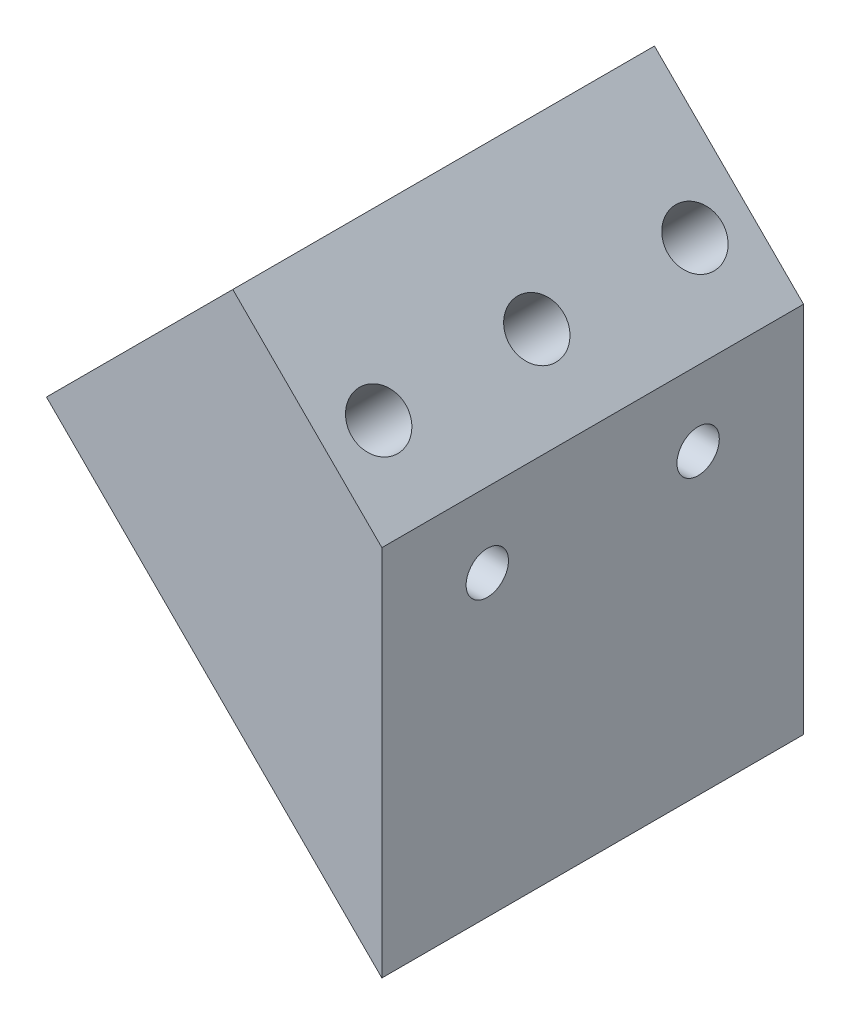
SolidWorks part; units mm, degrees
ref_plane "Front Plane" through (0, 0, 0) normal (0, 0, 1) x (1, 0, 0)
ref_plane "Top Plane" through (0, 0, 0) normal (0, 1, 0) x (1, 0, 0)
ref_plane "Right Plane" through (0, 0, 0) normal (1, 0, 0) x (0, 0, -1)
sketch "Sketch1" plane through (0, 0, 0) normal (0, 0, 1) x (1, 0, 0)
  line L1 (0, 0) -> (-40.4112, 40.4112)
  line L2 (-40.4112, 40.4112) -> (0, 80.8223)
  line L3 (0, 80.8223) -> (0, 0)
  dimension "D1" = 45
  dimension "D2" = 90
  dimension "D3" = 57.15
extrude "Boss-Extrude1" add sketch "Sketch1" along normal mid plane 50.8
hole_wizard "1/4-20 Tapped Hole1" positions "Sketch5" profile "Sketch4" tap size "1/4-20" standard "ANSI Inch"
sketch "Sketch5" plane through (0, 0, 0) normal (1, 0, 0) x (0, 0, -1)
  line L0 (-12.7, 35.9207) -> (12.7, 35.9207) construction
  line L2 (0, 0) -> (0, 35.9207) construction
  point P0 (-12.7, 35.9207)
  point P2 (12.7, 35.9207)
  dimension "D1" = 35.9207
  dimension "D2" = 25.4
sketch "Sketch4" plane through (0, 35.9207, 12.7) normal (0, 1, 0) x (0, 0, -1)
  line L0 (0, 0) -> (0, 40.4112)
  line L1 (0, 40.4112) -> (2.5527, 40.4112)
  line L2 (2.5527, 40.4112) -> (2.5527, 0)
  line L5 (2.5527, 0) -> (0, 0)
  line L11 (0, -6.35) -> (0, 107.95) construction
  dimension "Thru Tap Drill Dia." = 5.1054
  dimension "Thru Tap Drill Depth" = 40.4112
sketch "Sketch6" plane through (0, 0, 25.4) normal (0, 0, 1) x (1, 0, 0)
  line L0 (-17.9605, 62.8618) -> (0, 44.9013)
  line L1 (0, 80.8223) -> (-40.4112, 40.4112) construction
  line L2 (0, 0) -> (0, 80.8223) construction
  line L3 (0, 44.9013) -> (0, 80.8223)
  line L4 (0, 80.8223) -> (-17.9605, 62.8618)
  line L5 (-40.4112, 40.4112) -> (0, 0) construction
  dimension "D1" = 31.75
extrude "Cut-Extrude1" cut sketch "Sketch6" against normal through all
hole_wizard "1/4 Clearance Hole1" positions "Sketch8" profile "Sketch7" hole size "1/4" standard "ANSI Inch"
sketch "Sketch8" plane through (22.4506, 22.4506, 0) normal (0.7071, 0.7071, 0) x (0, 0, -1)
  line L0 (-19.05, 41.275) -> (19.05, 41.275) construction
  line L1 (0, 41.275) -> (0, 0) construction
  point P0 (-19.05, 41.275)
  point P4 (19.05, 41.275)
  point P10 (0, 41.275)
  dimension "D1" = 38.1
  dimension "D2" = 41.275
sketch "Sketch7" plane through (-6.7352, 51.6365, 19.05) normal (0, 0, 1) x (-0.7071, 0.7071, 0)
  line L0 (0, 0) -> (0, 60.325)
  line L1 (0, 60.325) -> (3.2639, 60.325)
  line L2 (3.2639, 60.325) -> (3.2639, 0)
  line L5 (3.2639, 0) -> (0, 0)
  line L11 (0, -6.35) -> (0, 107.95) construction
  dimension "Thru Hole Dia." = 6.5278
  dimension "Thru Hole Depth" = 60.325
